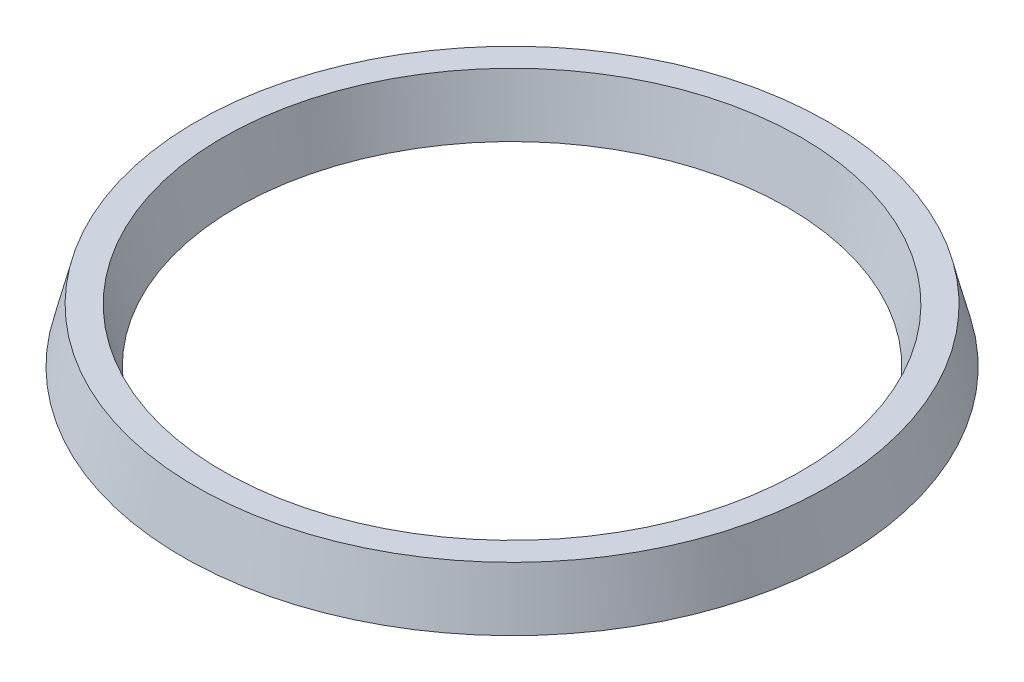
SolidWorks part; units mm, degrees
ref_plane "Front Plane" through (0, 0, 0) normal (0, 0, 1) x (1, 0, 0)
ref_plane "Top Plane" through (0, 0, 0) normal (0, 1, 0) x (1, 0, 0)
ref_plane "Right Plane" through (0, 0, 0) normal (1, 0, 0) x (0, 0, -1)
sketch "Sketch1" plane through (0, 0, 0) normal (0, 0, 1) x (1, 0, 0)
  line L0 (0, 49.8112) -> (0, 0) construction
  line L1 (0, 0) -> (-67.31, 0) construction
  line L2 (-67.31, 0) -> (-67.31, 45.6635) construction
  line L3 (3, 6) -> (-3, 6)
  line L4 (-3, 6) -> (-6, -6)
  line L5 (-6, -6) -> (-3, -6)
  line L6 (-3, -6) -> (-1.8638, -1.4552)
  line L7 (1.8638, -1.4552) -> (3, -6)
  line L8 (3, -6) -> (6, -6)
  line L9 (6, -6) -> (3, 6)
  arc A0 (-1.8638, -1.4552) -> (1.8638, -1.4552) centre (0, -1.9212) cw
  dimension "D1" = 67.31
  dimension "D2" = 6
  dimension "D3" = 12
  dimension "D4" = 3
  dimension "D5" = 12
  dimension "D6" = 6
  dimension "D7" = 6
  dimension "D8" = 3
revolve "Revolve1" add sketch "Sketch1" angle 360 about L2
